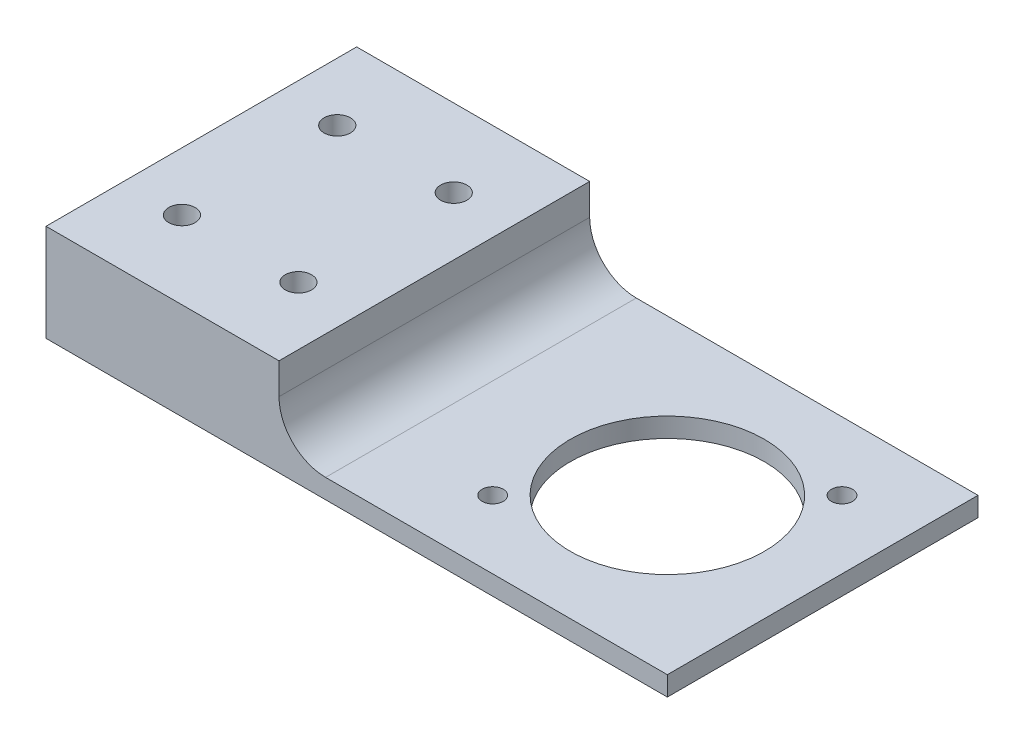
SolidWorks part; units mm, degrees
ref_plane "Front Plane" through (0, 0, 0) normal (0, 0, 1) x (1, 0, 0)
ref_plane "Top Plane" through (0, 0, 0) normal (0, 1, 0) x (1, 0, 0)
ref_plane "Right Plane" through (0, 0, 0) normal (1, 0, 0) x (0, 0, -1)
sketch "Sketch1" plane through (0, 0, 0) normal (0, 1, 0) x (1, 0, 0)
  line L2 (50.8, 25.4) -> (63.5, 25.4)
  line L3 (63.5, 25.4) -> (63.5, -25.4)
  line L4 (0, 0) -> (-47.453, 0) construction
  line L7 (63.5, -25.4) -> (50.8, -25.4)
  line L8 (50.8, 25.4) -> (0, 25.4)
  line L9 (0, 25.4) -> (0, -25.4) construction
  line L10 (0, -25.4) -> (50.8, -25.4)
  line L11 (-38.1, 25.4) -> (-38.1, -25.4)
  line L12 (-38.1, 25.4) -> (0, 25.4)
  line L13 (-38.1, -25.4) -> (0, -25.4)
  circle A0 centre (38.1, 0) radius 6.35 construction
  circle A1 centre (38.1, 0) radius 17.5 construction
  point P1 (0, 0)
  point P9 (44.45, 0)
  point P22 (63.5, 0)
  dimension "D1" = 19.05
  dimension "D3" = 38.1
  dimension "D2" = 12.7
  dimension "D4" = 35
  dimension "D5" = 50.8
  dimension "D6" = 38.1
extrude "Boss-Extrude1" add sketch "Sketch1" along normal blind 3.175
sketch "Sketch6" plane through (0, 3.175, 0) normal (0, 1, 0) x (1, 0, 0)
  line L0 (-38.1, 25.4) -> (-38.1, -25.4) construction
  line L1 (-38.1, 25.4) -> (0, 25.4)
  line L2 (-38.1, 25.4) -> (-38.1, -25.4)
  line L3 (-38.1, -25.4) -> (0, -25.4)
  line L4 (0, 25.4) -> (0, -25.4)
  line L5 (-38.1, -25.4) -> (63.5, -25.4) construction
  dimension "D1" = 38.1
  dimension "D2" = 50.8
extrude "Boss-Extrude3" add sketch "Sketch6" along normal blind 12.7
fillet "Fillet1" radius 7.62 1 edges at (0, 3.175, 0)
sketch "Sketch2" plane through (0, 3.175, 0) normal (0, 1, 0) x (1, 0, 0)
  line L0 (38.1, 0) -> (73.074, 0) construction
  line L1 (5.6791, -32.4209) -> (70.5209, 32.4209) construction
  line L2 (3.126, 34.974) -> (73.074, -34.974) construction
  circle A2 centre (38.1, 0) radius 17.5 construction
  circle A3 centre (50.4744, 12.3744) radius 2.1527
  circle A7 centre (50.4744, -12.3744) radius 2.1527
  circle A8 centre (25.7256, -12.3744) radius 2.1527
  circle A9 centre (25.7256, 12.3744) radius 2.1527
  circle A10 centre (38.1, 0) radius 5.2921 construction
  point P1 (0, 0)
  point P4 (50.4744, 12.3744)
  point P6 (25.7256, -12.3744)
  point P21 (38.1, 0)
  point P24 (38.1, 0)
  dimension "D1" = 35
  dimension "D2" = 4.3053
  dimension "D8" = 10.5841
  dimension "D3" = 45
  dimension "D4" = 45
  dimension "D5" = 38.1
  dimension "D6" = 12.3744
  dimension "D7" = 25.7256
extrude "MountingHolesM4" [suppressed] cut sketch "Sketch2" against normal up to surface (3.175 mm away)
sketch "Sketch5" plane through (0, 3.175, 0) normal (0, 1, 0) x (1, 0, 0)
  circle A0 centre (38.1, 0) radius 12.7
  dimension "D1" = 25.4
  dimension "D2" = 38.1
extrude "HoleFor25mmOutCropping" [suppressed] cut sketch "Sketch5" against normal up to surface (3.175 mm away)
sketch "Sketch7" plane through (0, 0, 0) normal (0, -1, 0) x (1, 0, 0)
  line L0 (0, 0) -> (-53.2461, 0) construction
  circle A0 centre (-9.525, -12.7) radius 2.1526
  circle A1 centre (-28.575, -12.7) radius 2.1527
  circle A10 centre (-9.525, 12.7) radius 2.1526
  circle A12 centre (-28.575, 12.7) radius 2.1527
  dimension "D4" = 4.3053
  dimension "D1" = 9.525
  dimension "D2" = 12.7
  dimension "D3" = 19.05
extrude "Cut-Extrude4" cut sketch "Sketch7" against normal up to surface (15.875 mm away)
sketch "Sketch8" plane through (0, 0, 0) normal (0, -1, 0) x (1, 0, 0)
  circle A2 centre (38.1, 0) radius 15.875
  dimension "D1" = 31.75
  dimension "D2" = 38.1
extrude "ThruHoleFor1.180\"BearingOD" cut sketch "Sketch8" against normal up to next
sketch "Sketch9" plane through (0, 0, 0) normal (0, -1, 0) x (1, 0, 0)
  line L0 (2.3424, 35.7576) -> (73.8576, -35.7576) construction
  line L1 (38.1, 0) -> (38.1, -76.7065) construction
  circle A0 centre (38.1, 0) radius 20.193 construction
  circle A1 centre (52.3786, -14.2786) radius 1.7272
  circle A2 centre (23.8214, 14.2786) radius 1.7272
  point P10 (38.1, 0)
  dimension "D2" = 40.386
  dimension "D3" = 3.4544
  dimension "D1" = 38.1
  dimension "D4" = 45
extrude "TappedHoleFor8-32,BoltMustBe.375\"Long" cut sketch "Sketch9" against normal up to next
